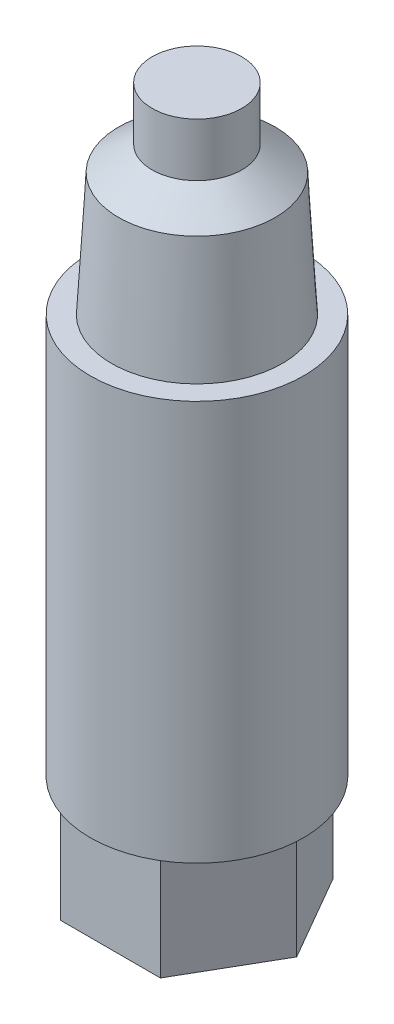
SolidWorks part; units mm, degrees
ref_plane "Front Plane" through (0, 0, 0) normal (0, 0, 1) x (1, 0, 0)
ref_plane "Top Plane" through (0, 0, 0) normal (0, 1, 0) x (1, 0, 0)
ref_plane "Right Plane" through (0, 0, 0) normal (1, 0, 0) x (0, 0, -1)
sketch "Sketch1" plane through (0, 0, 0) normal (0, 1, 0) x (1, 0, 0)
  line L0 (-5.9392, -10.287) -> (5.9392, -10.287)
  line L1 (5.9392, -10.287) -> (11.8784, 0)
  line L2 (11.8784, 0) -> (5.9392, 10.287)
  line L3 (5.9392, 10.287) -> (-5.9392, 10.287)
  line L4 (-5.9392, 10.287) -> (-11.8784, 0)
  line L5 (-11.8784, 0) -> (-5.9392, -10.287)
  line L6 (0, 10.287) -> (0, -10.287) construction
  dimension "D1" = 20.574
  dimension "D2" = 20.574
extrude "Extrude1" add sketch "Sketch1" along normal blind 12.7
sketch "Sketch2" plane through (0, 12.7, 0) normal (0, 1, 0) x (1, 0, 0)
  circle A0 centre (0, 0) radius 12.7
  dimension "D1" = 25.4
extrude "Extrude2" add sketch "Sketch2" along normal blind 47.625
sketch "Sketch3" plane through (0, 0, 0) normal (0, 0, 1) x (1, 0, 0)
  line L0 (0, 60.325) -> (0, 95.8227) construction
  line L1 (12.7, 60.325) -> (-12.7, 60.325) construction
  line L2 (-10.16, 60.325) -> (-9.3345, 74.9744)
  line L3 (-9.3345, 74.9744) -> (-5.334, 77.8735)
  line L4 (-5.334, 77.8735) -> (-5.334, 84.2235)
  line L5 (-5.334, 84.2235) -> (0, 84.2235)
  line L6 (0, 84.2235) -> (0, 60.325)
  line L7 (0, 60.325) -> (-10.16, 60.325)
  dimension "D1" = 10.16
  dimension "D2" = 9.3345
  dimension "D3" = 5.334
  dimension "D4" = 6.35
revolve "Revolve1" add sketch "Sketch3" angle 360 about L0
